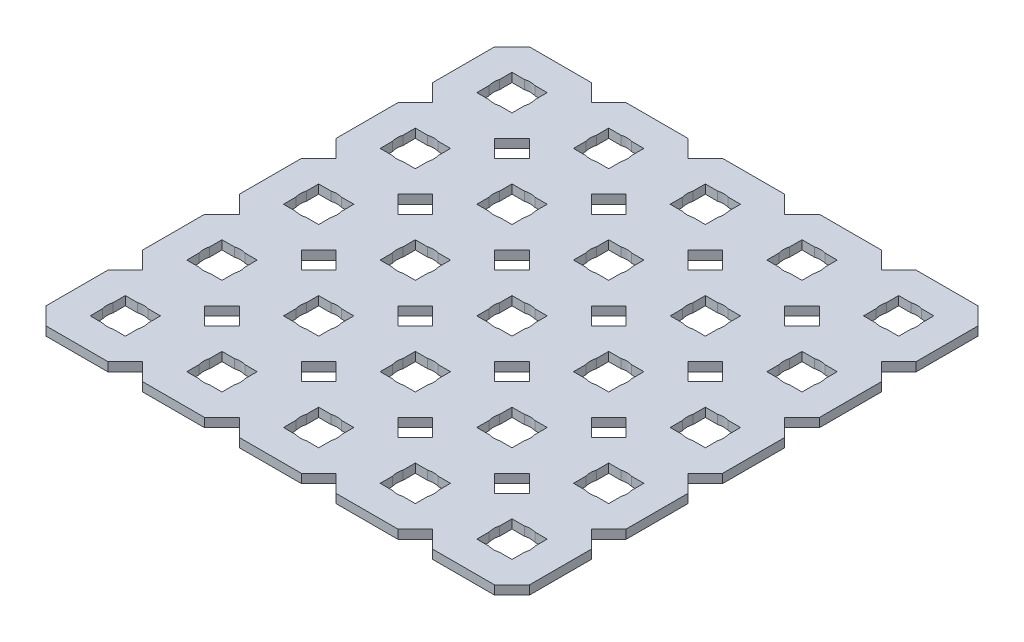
SolidWorks part; units mm, degrees
ref_plane "Front Plane" through (0, 0, 0) normal (0, 0, 1) x (1, 0, 0)
ref_plane "Top Plane" through (0, 0, 0) normal (0, 1, 0) x (1, 0, 0)
ref_plane "Right Plane" through (0, 0, 0) normal (1, 0, 0) x (0, 0, -1)
ref_plane "Plane1" through (0, 0, 0) normal (0, -1, 0) x (1, 0, 0)
sketch "Sketch1" plane through (0, 0, 0) normal (0, -1, 0) x (1, 0, 0)
  line L0 (2.281, -317.5) -> (10.419, -317.5)
  line L1 (10.419, -317.5) -> (12.7, -315.219)
  line L2 (12.7, -315.219) -> (14.981, -317.5)
  line L3 (14.981, -317.5) -> (23.119, -317.5)
  line L4 (23.119, -317.5) -> (25.4, -315.219)
  line L5 (25.4, -315.219) -> (27.681, -317.5)
  line L6 (27.681, -317.5) -> (35.819, -317.5)
  line L7 (35.819, -317.5) -> (38.1, -315.219)
  line L8 (38.1, -315.219) -> (40.381, -317.5)
  line L9 (40.381, -317.5) -> (48.519, -317.5)
  line L10 (48.519, -317.5) -> (50.8, -315.219)
  line L11 (50.8, -315.219) -> (53.081, -317.5)
  line L12 (53.081, -317.5) -> (61.219, -317.5)
  line L13 (61.219, -317.5) -> (63.5, -315.219)
  line L14 (63.5, -315.219) -> (63.5, -307.081)
  line L15 (63.5, -307.081) -> (61.219, -304.8)
  line L16 (61.219, -304.8) -> (63.5, -302.519)
  line L17 (63.5, -302.519) -> (63.5, -294.381)
  line L18 (63.5, -294.381) -> (61.219, -292.1)
  line L19 (61.219, -292.1) -> (63.5, -289.819)
  line L20 (63.5, -289.819) -> (63.5, -281.681)
  line L21 (63.5, -281.681) -> (61.219, -279.4)
  line L22 (61.219, -279.4) -> (63.5, -277.119)
  line L23 (63.5, -277.119) -> (63.5, -268.981)
  line L24 (63.5, -268.981) -> (61.219, -266.7)
  line L25 (61.219, -266.7) -> (63.5, -264.419)
  line L26 (63.5, -264.419) -> (63.5, -256.281)
  line L27 (63.5, -256.281) -> (61.219, -254)
  line L28 (61.219, -254) -> (63.5, -251.719)
  line L29 (63.5, -251.719) -> (63.5, -243.581)
  line L30 (63.5, -243.581) -> (61.219, -241.3)
  line L31 (61.219, -241.3) -> (63.5, -239.019)
  line L32 (63.5, -239.019) -> (63.5, -230.881)
  line L33 (63.5, -230.881) -> (61.219, -228.6)
  line L34 (61.219, -228.6) -> (63.5, -226.319)
  line L35 (63.5, -226.319) -> (63.5, -218.181)
  line L36 (63.5, -218.181) -> (61.219, -215.9)
  line L37 (61.219, -215.9) -> (63.5, -213.619)
  line L38 (63.5, -213.619) -> (63.5, -205.481)
  line L39 (63.5, -205.481) -> (61.219, -203.2)
  line L40 (61.219, -203.2) -> (63.5, -200.919)
  line L41 (63.5, -200.919) -> (63.5, -192.781)
  line L42 (63.5, -192.781) -> (61.219, -190.5)
  line L43 (61.219, -190.5) -> (63.5, -188.219)
  line L44 (63.5, -188.219) -> (63.5, -180.081)
  line L45 (63.5, -180.081) -> (61.219, -177.8)
  line L46 (61.219, -177.8) -> (63.5, -175.519)
  line L47 (63.5, -175.519) -> (63.5, -167.381)
  line L48 (63.5, -167.381) -> (61.219, -165.1)
  line L49 (61.219, -165.1) -> (63.5, -162.819)
  line L50 (63.5, -162.819) -> (63.5, -154.681)
  line L51 (63.5, -154.681) -> (61.219, -152.4)
  line L52 (61.219, -152.4) -> (63.5, -150.119)
  line L53 (63.5, -150.119) -> (63.5, -141.981)
  line L54 (63.5, -141.981) -> (61.219, -139.7)
  line L55 (61.219, -139.7) -> (63.5, -137.419)
  line L56 (63.5, -137.419) -> (63.5, -129.281)
  line L57 (63.5, -129.281) -> (61.219, -127)
  line L58 (61.219, -127) -> (63.5, -124.719)
  line L59 (63.5, -124.719) -> (63.5, -116.581)
  line L60 (63.5, -116.581) -> (61.219, -114.3)
  line L61 (61.219, -114.3) -> (63.5, -112.019)
  line L62 (63.5, -112.019) -> (63.5, -103.881)
  line L63 (63.5, -103.881) -> (61.219, -101.6)
  line L64 (61.219, -101.6) -> (63.5, -99.319)
  line L65 (63.5, -99.319) -> (63.5, -91.181)
  line L66 (63.5, -91.181) -> (61.219, -88.9)
  line L67 (61.219, -88.9) -> (63.5, -86.619)
  line L68 (63.5, -86.619) -> (63.5, -78.481)
  line L69 (63.5, -78.481) -> (61.219, -76.2)
  line L70 (61.219, -76.2) -> (63.5, -73.919)
  line L71 (63.5, -73.919) -> (63.5, -65.781)
  line L72 (63.5, -65.781) -> (61.219, -63.5)
  line L73 (61.219, -63.5) -> (63.5, -61.219)
  line L74 (63.5, -61.219) -> (63.5, -53.081)
  line L75 (63.5, -53.081) -> (61.219, -50.8)
  line L76 (61.219, -50.8) -> (63.5, -48.519)
  line L77 (63.5, -48.519) -> (63.5, -40.381)
  line L78 (63.5, -40.381) -> (61.219, -38.1)
  line L79 (61.219, -38.1) -> (63.5, -35.819)
  line L80 (63.5, -35.819) -> (63.5, -27.681)
  line L81 (63.5, -27.681) -> (61.219, -25.4)
  line L82 (61.219, -25.4) -> (63.5, -23.119)
  line L83 (63.5, -23.119) -> (63.5, -14.981)
  line L84 (63.5, -14.981) -> (61.219, -12.7)
  line L85 (61.219, -12.7) -> (63.5, -10.419)
  line L86 (63.5, -10.419) -> (63.5, -2.281)
  line L87 (63.5, -2.281) -> (61.219, 0)
  line L88 (61.219, 0) -> (53.081, 0)
  line L89 (53.081, 0) -> (50.8, -2.281)
  line L90 (50.8, -2.281) -> (48.519, 0)
  line L91 (48.519, 0) -> (40.381, 0)
  line L92 (40.381, 0) -> (38.1, -2.281)
  line L93 (38.1, -2.281) -> (35.819, 0)
  line L94 (35.819, 0) -> (27.681, 0)
  line L95 (27.681, 0) -> (25.4, -2.281)
  line L96 (25.4, -2.281) -> (23.119, 0)
  line L97 (23.119, 0) -> (14.981, 0)
  line L98 (14.981, 0) -> (12.7, -2.281)
  line L99 (12.7, -2.281) -> (10.419, 0)
  line L100 (10.419, 0) -> (2.281, 0)
  line L101 (2.281, 0) -> (0, -2.281)
  line L102 (0, -2.281) -> (0, -10.419)
  line L103 (0, -10.419) -> (2.281, -12.7)
  line L104 (2.281, -12.7) -> (0, -14.981)
  line L105 (0, -14.981) -> (0, -23.119)
  line L106 (0, -23.119) -> (2.281, -25.4)
  line L107 (2.281, -25.4) -> (0, -27.681)
  line L108 (0, -27.681) -> (0, -35.819)
  line L109 (0, -35.819) -> (2.281, -38.1)
  line L110 (2.281, -38.1) -> (0, -40.381)
  line L111 (0, -40.381) -> (0, -48.519)
  line L112 (0, -48.519) -> (2.281, -50.8)
  line L113 (2.281, -50.8) -> (0, -53.081)
  line L114 (0, -53.081) -> (0, -61.219)
  line L115 (0, -61.219) -> (2.281, -63.5)
  line L116 (2.281, -63.5) -> (0, -65.781)
  line L117 (0, -65.781) -> (0, -73.919)
  line L118 (0, -73.919) -> (2.281, -76.2)
  line L119 (2.281, -76.2) -> (0, -78.481)
  line L120 (0, -78.481) -> (0, -86.619)
  line L121 (0, -86.619) -> (2.281, -88.9)
  line L122 (2.281, -88.9) -> (0, -91.181)
  line L123 (0, -91.181) -> (0, -99.319)
  line L124 (0, -99.319) -> (2.281, -101.6)
  line L125 (2.281, -101.6) -> (0, -103.881)
  line L126 (0, -103.881) -> (0, -112.019)
  line L127 (0, -112.019) -> (2.281, -114.3)
  line L128 (2.281, -114.3) -> (0, -116.581)
  line L129 (0, -116.581) -> (0, -124.719)
  line L130 (0, -124.719) -> (2.281, -127)
  line L131 (2.281, -127) -> (0, -129.281)
  line L132 (0, -129.281) -> (0, -137.419)
  line L133 (0, -137.419) -> (2.281, -139.7)
  line L134 (2.281, -139.7) -> (0, -141.981)
  line L135 (0, -141.981) -> (0, -150.119)
  line L136 (0, -150.119) -> (2.281, -152.4)
  line L137 (2.281, -152.4) -> (0, -154.681)
  line L138 (0, -154.681) -> (0, -162.819)
  line L139 (0, -162.819) -> (2.281, -165.1)
  line L140 (2.281, -165.1) -> (0, -167.381)
  line L141 (0, -167.381) -> (0, -175.519)
  line L142 (0, -175.519) -> (2.281, -177.8)
  line L143 (2.281, -177.8) -> (0, -180.081)
  line L144 (0, -180.081) -> (0, -188.219)
  line L145 (0, -188.219) -> (2.281, -190.5)
  line L146 (2.281, -190.5) -> (0, -192.781)
  line L147 (0, -192.781) -> (0, -200.919)
  line L148 (0, -200.919) -> (2.281, -203.2)
  line L149 (2.281, -203.2) -> (0, -205.481)
  line L150 (0, -205.481) -> (0, -213.619)
  line L151 (0, -213.619) -> (2.281, -215.9)
  line L152 (2.281, -215.9) -> (0, -218.181)
  line L153 (0, -218.181) -> (0, -226.319)
  line L154 (0, -226.319) -> (2.281, -228.6)
  line L155 (2.281, -228.6) -> (0, -230.881)
  line L156 (0, -230.881) -> (0, -239.019)
  line L157 (0, -239.019) -> (2.281, -241.3)
  line L158 (2.281, -241.3) -> (0, -243.581)
  line L159 (0, -243.581) -> (0, -251.719)
  line L160 (0, -251.719) -> (2.281, -254)
  line L161 (2.281, -254) -> (0, -256.281)
  line L162 (0, -256.281) -> (0, -264.419)
  line L163 (0, -264.419) -> (2.281, -266.7)
  line L164 (2.281, -266.7) -> (0, -268.981)
  line L165 (0, -268.981) -> (0, -277.119)
  line L166 (0, -277.119) -> (2.281, -279.4)
  line L167 (2.281, -279.4) -> (0, -281.681)
  line L168 (0, -281.681) -> (0, -289.819)
  line L169 (0, -289.819) -> (2.281, -292.1)
  line L170 (2.281, -292.1) -> (0, -294.381)
  line L171 (0, -294.381) -> (0, -302.519)
  line L172 (0, -302.519) -> (2.281, -304.8)
  line L173 (2.281, -304.8) -> (0, -307.081)
  line L174 (0, -307.081) -> (0, -315.219)
  line L175 (0, -315.219) -> (2.281, -317.5)
  line L176 (14.981, -292.1) -> (12.7, -294.381)
  line L177 (12.7, -294.381) -> (10.419, -292.1)
  line L178 (10.419, -292.1) -> (12.7, -289.819)
  line L179 (12.7, -289.819) -> (14.981, -292.1)
  line L180 (14.981, -266.7) -> (12.7, -268.981)
  line L181 (12.7, -268.981) -> (10.419, -266.7)
  line L182 (10.419, -266.7) -> (12.7, -264.419)
  line L183 (12.7, -264.419) -> (14.981, -266.7)
  line L184 (14.981, -241.3) -> (12.7, -243.581)
  line L185 (12.7, -243.581) -> (10.419, -241.3)
  line L186 (10.419, -241.3) -> (12.7, -239.019)
  line L187 (12.7, -239.019) -> (14.981, -241.3)
  line L188 (14.981, -215.9) -> (12.7, -218.181)
  line L189 (12.7, -218.181) -> (10.419, -215.9)
  line L190 (10.419, -215.9) -> (12.7, -213.619)
  line L191 (12.7, -213.619) -> (14.981, -215.9)
  line L192 (14.981, -190.5) -> (12.7, -192.781)
  line L193 (12.7, -192.781) -> (10.419, -190.5)
  line L194 (10.419, -190.5) -> (12.7, -188.219)
  line L195 (12.7, -188.219) -> (14.981, -190.5)
  line L196 (14.981, -165.1) -> (12.7, -167.381)
  line L197 (12.7, -167.381) -> (10.419, -165.1)
  line L198 (10.419, -165.1) -> (12.7, -162.819)
  line L199 (12.7, -162.819) -> (14.981, -165.1)
  line L200 (14.981, -139.7) -> (12.7, -141.981)
  line L201 (12.7, -141.981) -> (10.419, -139.7)
  line L202 (10.419, -139.7) -> (12.7, -137.419)
  line L203 (12.7, -137.419) -> (14.981, -139.7)
  line L204 (14.981, -114.3) -> (12.7, -116.581)
  line L205 (12.7, -116.581) -> (10.419, -114.3)
  line L206 (10.419, -114.3) -> (12.7, -112.019)
  line L207 (12.7, -112.019) -> (14.981, -114.3)
  line L208 (14.981, -88.9) -> (12.7, -91.181)
  line L209 (12.7, -91.181) -> (10.419, -88.9)
  line L210 (10.419, -88.9) -> (12.7, -86.619)
  line L211 (12.7, -86.619) -> (14.981, -88.9)
  line L212 (14.981, -63.5) -> (12.7, -65.781)
  line L213 (12.7, -65.781) -> (10.419, -63.5)
  line L214 (10.419, -63.5) -> (12.7, -61.219)
  line L215 (12.7, -61.219) -> (14.981, -63.5)
  line L216 (14.981, -38.1) -> (12.7, -40.381)
  line L217 (12.7, -40.381) -> (10.419, -38.1)
  line L218 (10.419, -38.1) -> (12.7, -35.819)
  line L219 (12.7, -35.819) -> (14.981, -38.1)
  line L220 (14.981, -12.7) -> (12.7, -14.981)
  line L221 (12.7, -14.981) -> (10.419, -12.7)
  line L222 (10.419, -12.7) -> (12.7, -10.419)
  line L223 (12.7, -10.419) -> (14.981, -12.7)
  line L224 (27.681, -304.8) -> (25.4, -307.081)
  line L225 (25.4, -307.081) -> (23.119, -304.8)
  line L226 (23.119, -304.8) -> (25.4, -302.519)
  line L227 (25.4, -302.519) -> (27.681, -304.8)
  line L228 (27.681, -279.4) -> (25.4, -281.681)
  line L229 (25.4, -281.681) -> (23.119, -279.4)
  line L230 (23.119, -279.4) -> (25.4, -277.119)
  line L231 (25.4, -277.119) -> (27.681, -279.4)
  line L232 (27.681, -254) -> (25.4, -256.281)
  line L233 (25.4, -256.281) -> (23.119, -254)
  line L234 (23.119, -254) -> (25.4, -251.719)
  line L235 (25.4, -251.719) -> (27.681, -254)
  line L236 (27.681, -228.6) -> (25.4, -230.881)
  line L237 (25.4, -230.881) -> (23.119, -228.6)
  line L238 (23.119, -228.6) -> (25.4, -226.319)
  line L239 (25.4, -226.319) -> (27.681, -228.6)
  line L240 (27.681, -203.2) -> (25.4, -205.481)
  line L241 (25.4, -205.481) -> (23.119, -203.2)
  line L242 (23.119, -203.2) -> (25.4, -200.919)
  line L243 (25.4, -200.919) -> (27.681, -203.2)
  line L244 (27.681, -177.8) -> (25.4, -180.081)
  line L245 (25.4, -180.081) -> (23.119, -177.8)
  line L246 (23.119, -177.8) -> (25.4, -175.519)
  line L247 (25.4, -175.519) -> (27.681, -177.8)
  line L248 (27.681, -152.4) -> (25.4, -154.681)
  line L249 (25.4, -154.681) -> (23.119, -152.4)
  line L250 (23.119, -152.4) -> (25.4, -150.119)
  line L251 (25.4, -150.119) -> (27.681, -152.4)
  line L252 (27.681, -127) -> (25.4, -129.281)
  line L253 (25.4, -129.281) -> (23.119, -127)
  line L254 (23.119, -127) -> (25.4, -124.719)
  line L255 (25.4, -124.719) -> (27.681, -127)
  line L256 (27.681, -101.6) -> (25.4, -103.881)
  line L257 (25.4, -103.881) -> (23.119, -101.6)
  line L258 (23.119, -101.6) -> (25.4, -99.319)
  line L259 (25.4, -99.319) -> (27.681, -101.6)
  line L260 (27.681, -76.2) -> (25.4, -78.481)
  line L261 (25.4, -78.481) -> (23.119, -76.2)
  line L262 (23.119, -76.2) -> (25.4, -73.919)
  line L263 (25.4, -73.919) -> (27.681, -76.2)
  line L264 (27.681, -50.8) -> (25.4, -53.081)
  line L265 (25.4, -53.081) -> (23.119, -50.8)
  line L266 (23.119, -50.8) -> (25.4, -48.519)
  line L267 (25.4, -48.519) -> (27.681, -50.8)
  line L268 (27.681, -25.4) -> (25.4, -27.681)
  line L269 (25.4, -27.681) -> (23.119, -25.4)
  line L270 (23.119, -25.4) -> (25.4, -23.119)
  line L271 (25.4, -23.119) -> (27.681, -25.4)
  line L272 (40.381, -292.1) -> (38.1, -294.381)
  line L273 (38.1, -294.381) -> (35.819, -292.1)
  line L274 (35.819, -292.1) -> (38.1, -289.819)
  line L275 (38.1, -289.819) -> (40.381, -292.1)
  line L276 (40.381, -266.7) -> (38.1, -268.981)
  line L277 (38.1, -268.981) -> (35.819, -266.7)
  line L278 (35.819, -266.7) -> (38.1, -264.419)
  line L279 (38.1, -264.419) -> (40.381, -266.7)
  line L280 (40.381, -241.3) -> (38.1, -243.581)
  line L281 (38.1, -243.581) -> (35.819, -241.3)
  line L282 (35.819, -241.3) -> (38.1, -239.019)
  line L283 (38.1, -239.019) -> (40.381, -241.3)
  line L284 (40.381, -215.9) -> (38.1, -218.181)
  line L285 (38.1, -218.181) -> (35.819, -215.9)
  line L286 (35.819, -215.9) -> (38.1, -213.619)
  line L287 (38.1, -213.619) -> (40.381, -215.9)
  line L288 (40.381, -190.5) -> (38.1, -192.781)
  line L289 (38.1, -192.781) -> (35.819, -190.5)
  line L290 (35.819, -190.5) -> (38.1, -188.219)
  line L291 (38.1, -188.219) -> (40.381, -190.5)
  line L292 (40.381, -165.1) -> (38.1, -167.381)
  line L293 (38.1, -167.381) -> (35.819, -165.1)
  line L294 (35.819, -165.1) -> (38.1, -162.819)
  line L295 (38.1, -162.819) -> (40.381, -165.1)
  line L296 (40.381, -139.7) -> (38.1, -141.981)
  line L297 (38.1, -141.981) -> (35.819, -139.7)
  line L298 (35.819, -139.7) -> (38.1, -137.419)
  line L299 (38.1, -137.419) -> (40.381, -139.7)
  line L300 (40.381, -114.3) -> (38.1, -116.581)
  line L301 (38.1, -116.581) -> (35.819, -114.3)
  line L302 (35.819, -114.3) -> (38.1, -112.019)
  line L303 (38.1, -112.019) -> (40.381, -114.3)
  line L304 (40.381, -88.9) -> (38.1, -91.181)
  line L305 (38.1, -91.181) -> (35.819, -88.9)
  line L306 (35.819, -88.9) -> (38.1, -86.619)
  line L307 (38.1, -86.619) -> (40.381, -88.9)
  line L308 (40.381, -63.5) -> (38.1, -65.781)
  line L309 (38.1, -65.781) -> (35.819, -63.5)
  line L310 (35.819, -63.5) -> (38.1, -61.219)
  line L311 (38.1, -61.219) -> (40.381, -63.5)
  line L312 (40.381, -38.1) -> (38.1, -40.381)
  line L313 (38.1, -40.381) -> (35.819, -38.1)
  line L314 (35.819, -38.1) -> (38.1, -35.819)
  line L315 (38.1, -35.819) -> (40.381, -38.1)
  line L316 (40.381, -12.7) -> (38.1, -14.981)
  line L317 (38.1, -14.981) -> (35.819, -12.7)
  line L318 (35.819, -12.7) -> (38.1, -10.419)
  line L319 (38.1, -10.419) -> (40.381, -12.7)
  line L320 (53.081, -304.8) -> (50.8, -307.081)
  line L321 (50.8, -307.081) -> (48.519, -304.8)
  line L322 (48.519, -304.8) -> (50.8, -302.519)
  line L323 (50.8, -302.519) -> (53.081, -304.8)
  line L324 (53.081, -279.4) -> (50.8, -281.681)
  line L325 (50.8, -281.681) -> (48.519, -279.4)
  line L326 (48.519, -279.4) -> (50.8, -277.119)
  line L327 (50.8, -277.119) -> (53.081, -279.4)
  line L328 (53.081, -254) -> (50.8, -256.281)
  line L329 (50.8, -256.281) -> (48.519, -254)
  line L330 (48.519, -254) -> (50.8, -251.719)
  line L331 (50.8, -251.719) -> (53.081, -254)
  line L332 (53.081, -228.6) -> (50.8, -230.881)
  line L333 (50.8, -230.881) -> (48.519, -228.6)
  line L334 (48.519, -228.6) -> (50.8, -226.319)
  line L335 (50.8, -226.319) -> (53.081, -228.6)
  line L336 (53.081, -203.2) -> (50.8, -205.481)
  line L337 (50.8, -205.481) -> (48.519, -203.2)
  line L338 (48.519, -203.2) -> (50.8, -200.919)
  line L339 (50.8, -200.919) -> (53.081, -203.2)
  line L340 (53.081, -177.8) -> (50.8, -180.081)
  line L341 (50.8, -180.081) -> (48.519, -177.8)
  line L342 (48.519, -177.8) -> (50.8, -175.519)
  line L343 (50.8, -175.519) -> (53.081, -177.8)
  line L344 (53.081, -152.4) -> (50.8, -154.681)
  line L345 (50.8, -154.681) -> (48.519, -152.4)
  line L346 (48.519, -152.4) -> (50.8, -150.119)
  line L347 (50.8, -150.119) -> (53.081, -152.4)
  line L348 (53.081, -127) -> (50.8, -129.281)
  line L349 (50.8, -129.281) -> (48.519, -127)
  line L350 (48.519, -127) -> (50.8, -124.719)
  line L351 (50.8, -124.719) -> (53.081, -127)
  line L352 (53.081, -101.6) -> (50.8, -103.881)
  line L353 (50.8, -103.881) -> (48.519, -101.6)
  line L354 (48.519, -101.6) -> (50.8, -99.319)
  line L355 (50.8, -99.319) -> (53.081, -101.6)
  line L356 (53.081, -76.2) -> (50.8, -78.481)
  line L357 (50.8, -78.481) -> (48.519, -76.2)
  line L358 (48.519, -76.2) -> (50.8, -73.919)
  line L359 (50.8, -73.919) -> (53.081, -76.2)
  line L360 (53.081, -50.8) -> (50.8, -53.081)
  line L361 (50.8, -53.081) -> (48.519, -50.8)
  line L362 (48.519, -50.8) -> (50.8, -48.519)
  line L363 (50.8, -48.519) -> (53.081, -50.8)
  line L364 (53.081, -25.4) -> (50.8, -27.681)
  line L365 (50.8, -27.681) -> (48.519, -25.4)
  line L366 (48.519, -25.4) -> (50.8, -23.119)
  line L367 (50.8, -23.119) -> (53.081, -25.4)
  line L368 (4.0386, -308.8386) -> (8.6614, -308.8386)
  line L369 (8.6614, -308.8386) -> (8.6614, -313.4614)
  line L370 (8.6614, -313.4614) -> (4.0386, -313.4614)
  line L371 (4.0386, -313.4614) -> (4.0386, -308.8386)
  line L372 (16.7386, -308.8386) -> (21.3614, -308.8386)
  line L373 (21.3614, -308.8386) -> (21.3614, -313.4614)
  line L374 (21.3614, -313.4614) -> (16.7386, -313.4614)
  line L375 (16.7386, -313.4614) -> (16.7386, -308.8386)
  line L376 (29.4386, -308.8386) -> (34.0614, -308.8386)
  line L377 (34.0614, -308.8386) -> (34.0614, -313.4614)
  line L378 (34.0614, -313.4614) -> (29.4386, -313.4614)
  line L379 (29.4386, -313.4614) -> (29.4386, -308.8386)
  line L380 (42.1386, -308.8386) -> (46.7614, -308.8386)
  line L381 (46.7614, -308.8386) -> (46.7614, -313.4614)
  line L382 (46.7614, -313.4614) -> (42.1386, -313.4614)
  line L383 (42.1386, -313.4614) -> (42.1386, -308.8386)
  line L384 (54.8386, -308.8386) -> (59.4614, -308.8386)
  line L385 (59.4614, -308.8386) -> (59.4614, -313.4614)
  line L386 (59.4614, -313.4614) -> (54.8386, -313.4614)
  line L387 (54.8386, -313.4614) -> (54.8386, -308.8386)
  line L388 (4.0386, -296.1386) -> (8.6614, -296.1386)
  line L389 (8.6614, -296.1386) -> (8.6614, -300.7614)
  line L390 (8.6614, -300.7614) -> (4.0386, -300.7614)
  line L391 (4.0386, -300.7614) -> (4.0386, -296.1386)
  line L392 (54.8386, -296.1386) -> (59.4614, -296.1386)
  line L393 (59.4614, -296.1386) -> (59.4614, -300.7614)
  line L394 (59.4614, -300.7614) -> (54.8386, -300.7614)
  line L395 (54.8386, -300.7614) -> (54.8386, -296.1386)
  line L396 (4.0386, -283.4386) -> (8.6614, -283.4386)
  line L397 (8.6614, -283.4386) -> (8.6614, -288.0614)
  line L398 (8.6614, -288.0614) -> (4.0386, -288.0614)
  line L399 (4.0386, -288.0614) -> (4.0386, -283.4386)
  line L400 (54.8386, -283.4386) -> (59.4614, -283.4386)
  line L401 (59.4614, -283.4386) -> (59.4614, -288.0614)
  line L402 (59.4614, -288.0614) -> (54.8386, -288.0614)
  line L403 (54.8386, -288.0614) -> (54.8386, -283.4386)
  line L404 (4.0386, -270.7386) -> (8.6614, -270.7386)
  line L405 (8.6614, -270.7386) -> (8.6614, -275.3614)
  line L406 (8.6614, -275.3614) -> (4.0386, -275.3614)
  line L407 (4.0386, -275.3614) -> (4.0386, -270.7386)
  line L408 (54.8386, -270.7386) -> (59.4614, -270.7386)
  line L409 (59.4614, -270.7386) -> (59.4614, -275.3614)
  line L410 (59.4614, -275.3614) -> (54.8386, -275.3614)
  line L411 (54.8386, -275.3614) -> (54.8386, -270.7386)
  line L412 (4.0386, -258.0386) -> (8.6614, -258.0386)
  line L413 (8.6614, -258.0386) -> (8.6614, -262.6614)
  line L414 (8.6614, -262.6614) -> (4.0386, -262.6614)
  line L415 (4.0386, -262.6614) -> (4.0386, -258.0386)
  line L416 (54.8386, -258.0386) -> (59.4614, -258.0386)
  line L417 (59.4614, -258.0386) -> (59.4614, -262.6614)
  line L418 (59.4614, -262.6614) -> (54.8386, -262.6614)
  line L419 (54.8386, -262.6614) -> (54.8386, -258.0386)
  line L420 (4.0386, -245.3386) -> (8.6614, -245.3386)
  line L421 (8.6614, -245.3386) -> (8.6614, -249.9614)
  line L422 (8.6614, -249.9614) -> (4.0386, -249.9614)
  line L423 (4.0386, -249.9614) -> (4.0386, -245.3386)
  line L424 (54.8386, -245.3386) -> (59.4614, -245.3386)
  line L425 (59.4614, -245.3386) -> (59.4614, -249.9614)
  line L426 (59.4614, -249.9614) -> (54.8386, -249.9614)
  line L427 (54.8386, -249.9614) -> (54.8386, -245.3386)
  line L428 (4.0386, -232.6386) -> (8.6614, -232.6386)
  line L429 (8.6614, -232.6386) -> (8.6614, -237.2614)
  line L430 (8.6614, -237.2614) -> (4.0386, -237.2614)
  line L431 (4.0386, -237.2614) -> (4.0386, -232.6386)
  line L432 (54.8386, -232.6386) -> (59.4614, -232.6386)
  line L433 (59.4614, -232.6386) -> (59.4614, -237.2614)
  line L434 (59.4614, -237.2614) -> (54.8386, -237.2614)
  line L435 (54.8386, -237.2614) -> (54.8386, -232.6386)
  line L436 (4.0386, -219.9386) -> (8.6614, -219.9386)
  line L437 (8.6614, -219.9386) -> (8.6614, -224.5614)
  line L438 (8.6614, -224.5614) -> (4.0386, -224.5614)
  line L439 (4.0386, -224.5614) -> (4.0386, -219.9386)
  line L440 (54.8386, -219.9386) -> (59.4614, -219.9386)
  line L441 (59.4614, -219.9386) -> (59.4614, -224.5614)
  line L442 (59.4614, -224.5614) -> (54.8386, -224.5614)
  line L443 (54.8386, -224.5614) -> (54.8386, -219.9386)
  line L444 (4.0386, -207.2386) -> (8.6614, -207.2386)
  line L445 (8.6614, -207.2386) -> (8.6614, -211.8614)
  line L446 (8.6614, -211.8614) -> (4.0386, -211.8614)
  line L447 (4.0386, -211.8614) -> (4.0386, -207.2386)
  line L448 (54.8386, -207.2386) -> (59.4614, -207.2386)
  line L449 (59.4614, -207.2386) -> (59.4614, -211.8614)
  line L450 (59.4614, -211.8614) -> (54.8386, -211.8614)
  line L451 (54.8386, -211.8614) -> (54.8386, -207.2386)
  line L452 (4.0386, -194.5386) -> (8.6614, -194.5386)
  line L453 (8.6614, -194.5386) -> (8.6614, -199.1614)
  line L454 (8.6614, -199.1614) -> (4.0386, -199.1614)
  line L455 (4.0386, -199.1614) -> (4.0386, -194.5386)
  line L456 (54.8386, -194.5386) -> (59.4614, -194.5386)
  line L457 (59.4614, -194.5386) -> (59.4614, -199.1614)
  line L458 (59.4614, -199.1614) -> (54.8386, -199.1614)
  line L459 (54.8386, -199.1614) -> (54.8386, -194.5386)
  line L460 (4.0386, -181.8386) -> (8.6614, -181.8386)
  line L461 (8.6614, -181.8386) -> (8.6614, -186.4614)
  line L462 (8.6614, -186.4614) -> (4.0386, -186.4614)
  line L463 (4.0386, -186.4614) -> (4.0386, -181.8386)
  line L464 (54.8386, -181.8386) -> (59.4614, -181.8386)
  line L465 (59.4614, -181.8386) -> (59.4614, -186.4614)
  line L466 (59.4614, -186.4614) -> (54.8386, -186.4614)
  line L467 (54.8386, -186.4614) -> (54.8386, -181.8386)
  line L468 (4.0386, -169.1386) -> (8.6614, -169.1386)
  line L469 (8.6614, -169.1386) -> (8.6614, -173.7614)
  line L470 (8.6614, -173.7614) -> (4.0386, -173.7614)
  line L471 (4.0386, -173.7614) -> (4.0386, -169.1386)
  line L472 (54.8386, -169.1386) -> (59.4614, -169.1386)
  line L473 (59.4614, -169.1386) -> (59.4614, -173.7614)
  line L474 (59.4614, -173.7614) -> (54.8386, -173.7614)
  line L475 (54.8386, -173.7614) -> (54.8386, -169.1386)
  line L476 (4.0386, -156.4386) -> (8.6614, -156.4386)
  line L477 (8.6614, -156.4386) -> (8.6614, -161.0614)
  line L478 (8.6614, -161.0614) -> (4.0386, -161.0614)
  line L479 (4.0386, -161.0614) -> (4.0386, -156.4386)
  line L480 (54.8386, -156.4386) -> (59.4614, -156.4386)
  line L481 (59.4614, -156.4386) -> (59.4614, -161.0614)
  line L482 (59.4614, -161.0614) -> (54.8386, -161.0614)
  line L483 (54.8386, -161.0614) -> (54.8386, -156.4386)
  line L484 (4.0386, -143.7386) -> (8.6614, -143.7386)
  line L485 (8.6614, -143.7386) -> (8.6614, -148.3614)
  line L486 (8.6614, -148.3614) -> (4.0386, -148.3614)
  line L487 (4.0386, -148.3614) -> (4.0386, -143.7386)
  line L488 (54.8386, -143.7386) -> (59.4614, -143.7386)
  line L489 (59.4614, -143.7386) -> (59.4614, -148.3614)
  line L490 (59.4614, -148.3614) -> (54.8386, -148.3614)
  line L491 (54.8386, -148.3614) -> (54.8386, -143.7386)
  line L492 (4.0386, -131.0386) -> (8.6614, -131.0386)
  line L493 (8.6614, -131.0386) -> (8.6614, -135.6614)
  line L494 (8.6614, -135.6614) -> (4.0386, -135.6614)
  line L495 (4.0386, -135.6614) -> (4.0386, -131.0386)
  line L496 (54.8386, -131.0386) -> (59.4614, -131.0386)
  line L497 (59.4614, -131.0386) -> (59.4614, -135.6614)
  line L498 (59.4614, -135.6614) -> (54.8386, -135.6614)
  line L499 (54.8386, -135.6614) -> (54.8386, -131.0386)
  line L500 (4.0386, -118.3386) -> (8.6614, -118.3386)
  line L501 (8.6614, -118.3386) -> (8.6614, -122.9614)
  line L502 (8.6614, -122.9614) -> (4.0386, -122.9614)
  line L503 (4.0386, -122.9614) -> (4.0386, -118.3386)
  line L504 (54.8386, -118.3386) -> (59.4614, -118.3386)
  line L505 (59.4614, -118.3386) -> (59.4614, -122.9614)
  line L506 (59.4614, -122.9614) -> (54.8386, -122.9614)
  line L507 (54.8386, -122.9614) -> (54.8386, -118.3386)
  line L508 (4.0386, -105.6386) -> (8.6614, -105.6386)
  line L509 (8.6614, -105.6386) -> (8.6614, -110.2614)
  line L510 (8.6614, -110.2614) -> (4.0386, -110.2614)
  line L511 (4.0386, -110.2614) -> (4.0386, -105.6386)
  line L512 (54.8386, -105.6386) -> (59.4614, -105.6386)
  line L513 (59.4614, -105.6386) -> (59.4614, -110.2614)
  line L514 (59.4614, -110.2614) -> (54.8386, -110.2614)
  line L515 (54.8386, -110.2614) -> (54.8386, -105.6386)
  line L516 (4.0386, -92.9386) -> (8.6614, -92.9386)
  line L517 (8.6614, -92.9386) -> (8.6614, -97.5614)
  line L518 (8.6614, -97.5614) -> (4.0386, -97.5614)
  line L519 (4.0386, -97.5614) -> (4.0386, -92.9386)
  line L520 (54.8386, -92.9386) -> (59.4614, -92.9386)
  line L521 (59.4614, -92.9386) -> (59.4614, -97.5614)
  line L522 (59.4614, -97.5614) -> (54.8386, -97.5614)
  line L523 (54.8386, -97.5614) -> (54.8386, -92.9386)
  line L524 (4.0386, -80.2386) -> (8.6614, -80.2386)
  line L525 (8.6614, -80.2386) -> (8.6614, -84.8614)
  line L526 (8.6614, -84.8614) -> (4.0386, -84.8614)
  line L527 (4.0386, -84.8614) -> (4.0386, -80.2386)
  line L528 (54.8386, -80.2386) -> (59.4614, -80.2386)
  line L529 (59.4614, -80.2386) -> (59.4614, -84.8614)
  line L530 (59.4614, -84.8614) -> (54.8386, -84.8614)
  line L531 (54.8386, -84.8614) -> (54.8386, -80.2386)
  line L532 (4.0386, -67.5386) -> (8.6614, -67.5386)
  line L533 (8.6614, -67.5386) -> (8.6614, -72.1614)
  line L534 (8.6614, -72.1614) -> (4.0386, -72.1614)
  line L535 (4.0386, -72.1614) -> (4.0386, -67.5386)
  line L536 (54.8386, -67.5386) -> (59.4614, -67.5386)
  line L537 (59.4614, -67.5386) -> (59.4614, -72.1614)
  line L538 (59.4614, -72.1614) -> (54.8386, -72.1614)
  line L539 (54.8386, -72.1614) -> (54.8386, -67.5386)
  line L540 (4.0386, -54.8386) -> (8.6614, -54.8386)
  line L541 (8.6614, -54.8386) -> (8.6614, -59.4614)
  line L542 (8.6614, -59.4614) -> (4.0386, -59.4614)
  line L543 (4.0386, -59.4614) -> (4.0386, -54.8386)
  line L544 (54.8386, -54.8386) -> (59.4614, -54.8386)
  line L545 (59.4614, -54.8386) -> (59.4614, -59.4614)
  line L546 (59.4614, -59.4614) -> (54.8386, -59.4614)
  line L547 (54.8386, -59.4614) -> (54.8386, -54.8386)
  line L548 (4.0386, -42.1386) -> (8.6614, -42.1386)
  line L549 (8.6614, -42.1386) -> (8.6614, -46.7614)
  line L550 (8.6614, -46.7614) -> (4.0386, -46.7614)
  line L551 (4.0386, -46.7614) -> (4.0386, -42.1386)
  line L552 (54.8386, -42.1386) -> (59.4614, -42.1386)
  line L553 (59.4614, -42.1386) -> (59.4614, -46.7614)
  line L554 (59.4614, -46.7614) -> (54.8386, -46.7614)
  line L555 (54.8386, -46.7614) -> (54.8386, -42.1386)
  line L556 (4.0386, -29.4386) -> (8.6614, -29.4386)
  line L557 (8.6614, -29.4386) -> (8.6614, -34.0614)
  line L558 (8.6614, -34.0614) -> (4.0386, -34.0614)
  line L559 (4.0386, -34.0614) -> (4.0386, -29.4386)
  line L560 (54.8386, -29.4386) -> (59.4614, -29.4386)
  line L561 (59.4614, -29.4386) -> (59.4614, -34.0614)
  line L562 (59.4614, -34.0614) -> (54.8386, -34.0614)
  line L563 (54.8386, -34.0614) -> (54.8386, -29.4386)
  line L564 (4.0386, -16.7386) -> (8.6614, -16.7386)
  line L565 (8.6614, -16.7386) -> (8.6614, -21.3614)
  line L566 (8.6614, -21.3614) -> (4.0386, -21.3614)
  line L567 (4.0386, -21.3614) -> (4.0386, -16.7386)
  line L568 (54.8386, -16.7386) -> (59.4614, -16.7386)
  line L569 (59.4614, -16.7386) -> (59.4614, -21.3614)
  line L570 (59.4614, -21.3614) -> (54.8386, -21.3614)
  line L571 (54.8386, -21.3614) -> (54.8386, -16.7386)
  line L572 (4.0386, -4.0386) -> (8.6614, -4.0386)
  line L573 (8.6614, -4.0386) -> (8.6614, -8.6614)
  line L574 (8.6614, -8.6614) -> (4.0386, -8.6614)
  line L575 (4.0386, -8.6614) -> (4.0386, -4.0386)
  line L576 (16.7386, -4.0386) -> (21.3614, -4.0386)
  line L577 (21.3614, -4.0386) -> (21.3614, -8.6614)
  line L578 (21.3614, -8.6614) -> (16.7386, -8.6614)
  line L579 (16.7386, -8.6614) -> (16.7386, -4.0386)
  line L580 (29.4386, -4.0386) -> (34.0614, -4.0386)
  line L581 (34.0614, -4.0386) -> (34.0614, -8.6614)
  line L582 (34.0614, -8.6614) -> (29.4386, -8.6614)
  line L583 (29.4386, -8.6614) -> (29.4386, -4.0386)
  line L584 (16.7386, -296.1386) -> (21.3614, -296.1386)
  line L585 (21.3614, -296.1386) -> (21.3614, -300.7614)
  line L586 (21.3614, -300.7614) -> (16.7386, -300.7614)
  line L587 (16.7386, -300.7614) -> (16.7386, -296.1386)
  line L588 (29.4386, -296.1386) -> (34.0614, -296.1386)
  line L589 (34.0614, -296.1386) -> (34.0614, -300.7614)
  line L590 (34.0614, -300.7614) -> (29.4386, -300.7614)
  line L591 (29.4386, -300.7614) -> (29.4386, -296.1386)
  line L592 (42.1386, -296.1386) -> (46.7614, -296.1386)
  line L593 (46.7614, -296.1386) -> (46.7614, -300.7614)
  line L594 (46.7614, -300.7614) -> (42.1386, -300.7614)
  line L595 (42.1386, -300.7614) -> (42.1386, -296.1386)
  line L596 (16.7386, -283.4386) -> (21.3614, -283.4386)
  line L597 (21.3614, -283.4386) -> (21.3614, -288.0614)
  line L598 (21.3614, -288.0614) -> (16.7386, -288.0614)
  line L599 (16.7386, -288.0614) -> (16.7386, -283.4386)
  line L600 (29.4386, -283.4386) -> (34.0614, -283.4386)
  line L601 (34.0614, -283.4386) -> (34.0614, -288.0614)
  line L602 (34.0614, -288.0614) -> (29.4386, -288.0614)
  line L603 (29.4386, -288.0614) -> (29.4386, -283.4386)
  line L604 (42.1386, -283.4386) -> (46.7614, -283.4386)
  line L605 (46.7614, -283.4386) -> (46.7614, -288.0614)
  line L606 (46.7614, -288.0614) -> (42.1386, -288.0614)
  line L607 (42.1386, -288.0614) -> (42.1386, -283.4386)
  line L608 (16.7386, -270.7386) -> (21.3614, -270.7386)
  line L609 (21.3614, -270.7386) -> (21.3614, -275.3614)
  line L610 (21.3614, -275.3614) -> (16.7386, -275.3614)
  line L611 (16.7386, -275.3614) -> (16.7386, -270.7386)
  line L612 (29.4386, -270.7386) -> (34.0614, -270.7386)
  line L613 (34.0614, -270.7386) -> (34.0614, -275.3614)
  line L614 (34.0614, -275.3614) -> (29.4386, -275.3614)
  line L615 (29.4386, -275.3614) -> (29.4386, -270.7386)
  line L616 (42.1386, -270.7386) -> (46.7614, -270.7386)
  line L617 (46.7614, -270.7386) -> (46.7614, -275.3614)
  line L618 (46.7614, -275.3614) -> (42.1386, -275.3614)
  line L619 (42.1386, -275.3614) -> (42.1386, -270.7386)
  line L620 (16.7386, -258.0386) -> (21.3614, -258.0386)
  line L621 (21.3614, -258.0386) -> (21.3614, -262.6614)
  line L622 (21.3614, -262.6614) -> (16.7386, -262.6614)
  line L623 (16.7386, -262.6614) -> (16.7386, -258.0386)
  line L624 (29.4386, -258.0386) -> (34.0614, -258.0386)
  line L625 (34.0614, -258.0386) -> (34.0614, -262.6614)
  line L626 (34.0614, -262.6614) -> (29.4386, -262.6614)
  line L627 (29.4386, -262.6614) -> (29.4386, -258.0386)
  line L628 (42.1386, -258.0386) -> (46.7614, -258.0386)
  line L629 (46.7614, -258.0386) -> (46.7614, -262.6614)
  line L630 (46.7614, -262.6614) -> (42.1386, -262.6614)
  line L631 (42.1386, -262.6614) -> (42.1386, -258.0386)
  line L632 (16.7386, -245.3386) -> (21.3614, -245.3386)
  line L633 (21.3614, -245.3386) -> (21.3614, -249.9614)
  line L634 (21.3614, -249.9614) -> (16.7386, -249.9614)
  line L635 (16.7386, -249.9614) -> (16.7386, -245.3386)
  line L636 (29.4386, -245.3386) -> (34.0614, -245.3386)
  line L637 (34.0614, -245.3386) -> (34.0614, -249.9614)
  line L638 (34.0614, -249.9614) -> (29.4386, -249.9614)
  line L639 (29.4386, -249.9614) -> (29.4386, -245.3386)
  line L640 (42.1386, -245.3386) -> (46.7614, -245.3386)
  line L641 (46.7614, -245.3386) -> (46.7614, -249.9614)
  line L642 (46.7614, -249.9614) -> (42.1386, -249.9614)
  line L643 (42.1386, -249.9614) -> (42.1386, -245.3386)
  line L644 (16.7386, -232.6386) -> (21.3614, -232.6386)
  line L645 (21.3614, -232.6386) -> (21.3614, -237.2614)
  line L646 (21.3614, -237.2614) -> (16.7386, -237.2614)
  line L647 (16.7386, -237.2614) -> (16.7386, -232.6386)
  line L648 (29.4386, -232.6386) -> (34.0614, -232.6386)
  line L649 (34.0614, -232.6386) -> (34.0614, -237.2614)
  line L650 (34.0614, -237.2614) -> (29.4386, -237.2614)
  line L651 (29.4386, -237.2614) -> (29.4386, -232.6386)
  line L652 (42.1386, -232.6386) -> (46.7614, -232.6386)
  line L653 (46.7614, -232.6386) -> (46.7614, -237.2614)
  line L654 (46.7614, -237.2614) -> (42.1386, -237.2614)
  line L655 (42.1386, -237.2614) -> (42.1386, -232.6386)
  line L656 (16.7386, -219.9386) -> (21.3614, -219.9386)
  line L657 (21.3614, -219.9386) -> (21.3614, -224.5614)
  line L658 (21.3614, -224.5614) -> (16.7386, -224.5614)
  line L659 (16.7386, -224.5614) -> (16.7386, -219.9386)
  line L660 (29.4386, -219.9386) -> (34.0614, -219.9386)
  line L661 (34.0614, -219.9386) -> (34.0614, -224.5614)
  line L662 (34.0614, -224.5614) -> (29.4386, -224.5614)
  line L663 (29.4386, -224.5614) -> (29.4386, -219.9386)
  line L664 (42.1386, -219.9386) -> (46.7614, -219.9386)
  line L665 (46.7614, -219.9386) -> (46.7614, -224.5614)
  line L666 (46.7614, -224.5614) -> (42.1386, -224.5614)
  line L667 (42.1386, -224.5614) -> (42.1386, -219.9386)
  line L668 (16.7386, -207.2386) -> (21.3614, -207.2386)
  line L669 (21.3614, -207.2386) -> (21.3614, -211.8614)
  line L670 (21.3614, -211.8614) -> (16.7386, -211.8614)
  line L671 (16.7386, -211.8614) -> (16.7386, -207.2386)
  line L672 (29.4386, -207.2386) -> (34.0614, -207.2386)
  line L673 (34.0614, -207.2386) -> (34.0614, -211.8614)
  line L674 (34.0614, -211.8614) -> (29.4386, -211.8614)
  line L675 (29.4386, -211.8614) -> (29.4386, -207.2386)
  line L676 (42.1386, -207.2386) -> (46.7614, -207.2386)
  line L677 (46.7614, -207.2386) -> (46.7614, -211.8614)
  line L678 (46.7614, -211.8614) -> (42.1386, -211.8614)
  line L679 (42.1386, -211.8614) -> (42.1386, -207.2386)
  line L680 (16.7386, -194.5386) -> (21.3614, -194.5386)
  line L681 (21.3614, -194.5386) -> (21.3614, -199.1614)
  line L682 (21.3614, -199.1614) -> (16.7386, -199.1614)
  line L683 (16.7386, -199.1614) -> (16.7386, -194.5386)
  line L684 (29.4386, -194.5386) -> (34.0614, -194.5386)
  line L685 (34.0614, -194.5386) -> (34.0614, -199.1614)
  line L686 (34.0614, -199.1614) -> (29.4386, -199.1614)
  line L687 (29.4386, -199.1614) -> (29.4386, -194.5386)
  line L688 (42.1386, -194.5386) -> (46.7614, -194.5386)
  line L689 (46.7614, -194.5386) -> (46.7614, -199.1614)
  line L690 (46.7614, -199.1614) -> (42.1386, -199.1614)
  line L691 (42.1386, -199.1614) -> (42.1386, -194.5386)
  line L692 (16.7386, -181.8386) -> (21.3614, -181.8386)
  line L693 (21.3614, -181.8386) -> (21.3614, -186.4614)
  line L694 (21.3614, -186.4614) -> (16.7386, -186.4614)
  line L695 (16.7386, -186.4614) -> (16.7386, -181.8386)
  line L696 (29.4386, -181.8386) -> (34.0614, -181.8386)
  line L697 (34.0614, -181.8386) -> (34.0614, -186.4614)
  line L698 (34.0614, -186.4614) -> (29.4386, -186.4614)
  line L699 (29.4386, -186.4614) -> (29.4386, -181.8386)
  line L700 (42.1386, -181.8386) -> (46.7614, -181.8386)
  line L701 (46.7614, -181.8386) -> (46.7614, -186.4614)
  line L702 (46.7614, -186.4614) -> (42.1386, -186.4614)
  line L703 (42.1386, -186.4614) -> (42.1386, -181.8386)
  line L704 (16.7386, -169.1386) -> (21.3614, -169.1386)
  line L705 (21.3614, -169.1386) -> (21.3614, -173.7614)
  line L706 (21.3614, -173.7614) -> (16.7386, -173.7614)
  line L707 (16.7386, -173.7614) -> (16.7386, -169.1386)
  line L708 (29.4386, -169.1386) -> (34.0614, -169.1386)
  line L709 (34.0614, -169.1386) -> (34.0614, -173.7614)
  line L710 (34.0614, -173.7614) -> (29.4386, -173.7614)
  line L711 (29.4386, -173.7614) -> (29.4386, -169.1386)
  line L712 (42.1386, -169.1386) -> (46.7614, -169.1386)
  line L713 (46.7614, -169.1386) -> (46.7614, -173.7614)
  line L714 (46.7614, -173.7614) -> (42.1386, -173.7614)
  line L715 (42.1386, -173.7614) -> (42.1386, -169.1386)
  line L716 (16.7386, -156.4386) -> (21.3614, -156.4386)
  line L717 (21.3614, -156.4386) -> (21.3614, -161.0614)
  line L718 (21.3614, -161.0614) -> (16.7386, -161.0614)
  line L719 (16.7386, -161.0614) -> (16.7386, -156.4386)
  line L720 (29.4386, -156.4386) -> (34.0614, -156.4386)
  line L721 (34.0614, -156.4386) -> (34.0614, -161.0614)
  line L722 (34.0614, -161.0614) -> (29.4386, -161.0614)
  line L723 (29.4386, -161.0614) -> (29.4386, -156.4386)
  line L724 (42.1386, -156.4386) -> (46.7614, -156.4386)
  line L725 (46.7614, -156.4386) -> (46.7614, -161.0614)
  line L726 (46.7614, -161.0614) -> (42.1386, -161.0614)
  line L727 (42.1386, -161.0614) -> (42.1386, -156.4386)
  line L728 (16.7386, -143.7386) -> (21.3614, -143.7386)
  line L729 (21.3614, -143.7386) -> (21.3614, -148.3614)
  line L730 (21.3614, -148.3614) -> (16.7386, -148.3614)
  line L731 (16.7386, -148.3614) -> (16.7386, -143.7386)
  line L732 (29.4386, -143.7386) -> (34.0614, -143.7386)
  line L733 (34.0614, -143.7386) -> (34.0614, -148.3614)
  line L734 (34.0614, -148.3614) -> (29.4386, -148.3614)
  line L735 (29.4386, -148.3614) -> (29.4386, -143.7386)
  line L736 (42.1386, -143.7386) -> (46.7614, -143.7386)
  line L737 (46.7614, -143.7386) -> (46.7614, -148.3614)
  line L738 (46.7614, -148.3614) -> (42.1386, -148.3614)
  line L739 (42.1386, -148.3614) -> (42.1386, -143.7386)
  line L740 (16.7386, -131.0386) -> (21.3614, -131.0386)
  line L741 (21.3614, -131.0386) -> (21.3614, -135.6614)
  line L742 (21.3614, -135.6614) -> (16.7386, -135.6614)
  line L743 (16.7386, -135.6614) -> (16.7386, -131.0386)
  line L744 (29.4386, -131.0386) -> (34.0614, -131.0386)
  line L745 (34.0614, -131.0386) -> (34.0614, -135.6614)
  line L746 (34.0614, -135.6614) -> (29.4386, -135.6614)
  line L747 (29.4386, -135.6614) -> (29.4386, -131.0386)
  line L748 (42.1386, -131.0386) -> (46.7614, -131.0386)
  line L749 (46.7614, -131.0386) -> (46.7614, -135.6614)
  line L750 (46.7614, -135.6614) -> (42.1386, -135.6614)
  line L751 (42.1386, -135.6614) -> (42.1386, -131.0386)
  line L752 (16.7386, -118.3386) -> (21.3614, -118.3386)
  line L753 (21.3614, -118.3386) -> (21.3614, -122.9614)
  line L754 (21.3614, -122.9614) -> (16.7386, -122.9614)
  line L755 (16.7386, -122.9614) -> (16.7386, -118.3386)
  line L756 (29.4386, -118.3386) -> (34.0614, -118.3386)
  line L757 (34.0614, -118.3386) -> (34.0614, -122.9614)
  line L758 (34.0614, -122.9614) -> (29.4386, -122.9614)
  line L759 (29.4386, -122.9614) -> (29.4386, -118.3386)
  line L760 (42.1386, -118.3386) -> (46.7614, -118.3386)
  line L761 (46.7614, -118.3386) -> (46.7614, -122.9614)
  line L762 (46.7614, -122.9614) -> (42.1386, -122.9614)
  line L763 (42.1386, -122.9614) -> (42.1386, -118.3386)
  line L764 (16.7386, -105.6386) -> (21.3614, -105.6386)
  line L765 (21.3614, -105.6386) -> (21.3614, -110.2614)
  line L766 (21.3614, -110.2614) -> (16.7386, -110.2614)
  line L767 (16.7386, -110.2614) -> (16.7386, -105.6386)
  line L768 (29.4386, -105.6386) -> (34.0614, -105.6386)
  line L769 (34.0614, -105.6386) -> (34.0614, -110.2614)
  line L770 (34.0614, -110.2614) -> (29.4386, -110.2614)
  line L771 (29.4386, -110.2614) -> (29.4386, -105.6386)
  line L772 (42.1386, -105.6386) -> (46.7614, -105.6386)
  line L773 (46.7614, -105.6386) -> (46.7614, -110.2614)
  line L774 (46.7614, -110.2614) -> (42.1386, -110.2614)
  line L775 (42.1386, -110.2614) -> (42.1386, -105.6386)
  line L776 (16.7386, -92.9386) -> (21.3614, -92.9386)
  line L777 (21.3614, -92.9386) -> (21.3614, -97.5614)
  line L778 (21.3614, -97.5614) -> (16.7386, -97.5614)
  line L779 (16.7386, -97.5614) -> (16.7386, -92.9386)
  line L780 (29.4386, -92.9386) -> (34.0614, -92.9386)
  line L781 (34.0614, -92.9386) -> (34.0614, -97.5614)
  line L782 (34.0614, -97.5614) -> (29.4386, -97.5614)
  line L783 (29.4386, -97.5614) -> (29.4386, -92.9386)
  line L784 (42.1386, -92.9386) -> (46.7614, -92.9386)
  line L785 (46.7614, -92.9386) -> (46.7614, -97.5614)
  line L786 (46.7614, -97.5614) -> (42.1386, -97.5614)
  line L787 (42.1386, -97.5614) -> (42.1386, -92.9386)
  line L788 (16.7386, -80.2386) -> (21.3614, -80.2386)
  line L789 (21.3614, -80.2386) -> (21.3614, -84.8614)
  line L790 (21.3614, -84.8614) -> (16.7386, -84.8614)
  line L791 (16.7386, -84.8614) -> (16.7386, -80.2386)
  line L792 (29.4386, -80.2386) -> (34.0614, -80.2386)
  line L793 (34.0614, -80.2386) -> (34.0614, -84.8614)
  line L794 (34.0614, -84.8614) -> (29.4386, -84.8614)
  line L795 (29.4386, -84.8614) -> (29.4386, -80.2386)
  line L796 (42.1386, -80.2386) -> (46.7614, -80.2386)
  line L797 (46.7614, -80.2386) -> (46.7614, -84.8614)
  line L798 (46.7614, -84.8614) -> (42.1386, -84.8614)
  line L799 (42.1386, -84.8614) -> (42.1386, -80.2386)
  line L800 (16.7386, -67.5386) -> (21.3614, -67.5386)
  line L801 (21.3614, -67.5386) -> (21.3614, -72.1614)
  line L802 (21.3614, -72.1614) -> (16.7386, -72.1614)
  line L803 (16.7386, -72.1614) -> (16.7386, -67.5386)
  line L804 (29.4386, -67.5386) -> (34.0614, -67.5386)
  line L805 (34.0614, -67.5386) -> (34.0614, -72.1614)
  line L806 (34.0614, -72.1614) -> (29.4386, -72.1614)
  line L807 (29.4386, -72.1614) -> (29.4386, -67.5386)
  line L808 (42.1386, -67.5386) -> (46.7614, -67.5386)
  line L809 (46.7614, -67.5386) -> (46.7614, -72.1614)
  line L810 (46.7614, -72.1614) -> (42.1386, -72.1614)
  line L811 (42.1386, -72.1614) -> (42.1386, -67.5386)
  line L812 (16.7386, -54.8386) -> (21.3614, -54.8386)
  line L813 (21.3614, -54.8386) -> (21.3614, -59.4614)
  line L814 (21.3614, -59.4614) -> (16.7386, -59.4614)
  line L815 (16.7386, -59.4614) -> (16.7386, -54.8386)
  line L816 (29.4386, -54.8386) -> (34.0614, -54.8386)
  line L817 (34.0614, -54.8386) -> (34.0614, -59.4614)
  line L818 (34.0614, -59.4614) -> (29.4386, -59.4614)
  line L819 (29.4386, -59.4614) -> (29.4386, -54.8386)
  line L820 (42.1386, -54.8386) -> (46.7614, -54.8386)
  line L821 (46.7614, -54.8386) -> (46.7614, -59.4614)
  line L822 (46.7614, -59.4614) -> (42.1386, -59.4614)
  line L823 (42.1386, -59.4614) -> (42.1386, -54.8386)
  line L824 (16.7386, -42.1386) -> (21.3614, -42.1386)
  line L825 (21.3614, -42.1386) -> (21.3614, -46.7614)
  line L826 (21.3614, -46.7614) -> (16.7386, -46.7614)
  line L827 (16.7386, -46.7614) -> (16.7386, -42.1386)
  line L828 (29.4386, -42.1386) -> (34.0614, -42.1386)
  line L829 (34.0614, -42.1386) -> (34.0614, -46.7614)
  line L830 (34.0614, -46.7614) -> (29.4386, -46.7614)
  line L831 (29.4386, -46.7614) -> (29.4386, -42.1386)
  line L832 (42.1386, -42.1386) -> (46.7614, -42.1386)
  line L833 (46.7614, -42.1386) -> (46.7614, -46.7614)
  line L834 (46.7614, -46.7614) -> (42.1386, -46.7614)
  line L835 (42.1386, -46.7614) -> (42.1386, -42.1386)
  line L836 (16.7386, -29.4386) -> (21.3614, -29.4386)
  line L837 (21.3614, -29.4386) -> (21.3614, -34.0614)
  line L838 (21.3614, -34.0614) -> (16.7386, -34.0614)
  line L839 (16.7386, -34.0614) -> (16.7386, -29.4386)
  line L840 (29.4386, -29.4386) -> (34.0614, -29.4386)
  line L841 (34.0614, -29.4386) -> (34.0614, -34.0614)
  line L842 (34.0614, -34.0614) -> (29.4386, -34.0614)
  line L843 (29.4386, -34.0614) -> (29.4386, -29.4386)
  line L844 (42.1386, -29.4386) -> (46.7614, -29.4386)
  line L845 (46.7614, -29.4386) -> (46.7614, -34.0614)
  line L846 (46.7614, -34.0614) -> (42.1386, -34.0614)
  line L847 (42.1386, -34.0614) -> (42.1386, -29.4386)
  line L848 (16.7386, -16.7386) -> (21.3614, -16.7386)
  line L849 (21.3614, -16.7386) -> (21.3614, -21.3614)
  line L850 (21.3614, -21.3614) -> (16.7386, -21.3614)
  line L851 (16.7386, -21.3614) -> (16.7386, -16.7386)
  line L852 (29.4386, -16.7386) -> (34.0614, -16.7386)
  line L853 (34.0614, -16.7386) -> (34.0614, -21.3614)
  line L854 (34.0614, -21.3614) -> (29.4386, -21.3614)
  line L855 (29.4386, -21.3614) -> (29.4386, -16.7386)
  line L856 (54.8386, -8.6614) -> (54.8386, -4.0386)
  line L857 (54.8386, -4.0386) -> (59.4614, -4.0386)
  line L858 (59.4614, -4.0386) -> (59.4614, -8.6614)
  line L859 (59.4614, -8.6614) -> (54.8386, -8.6614)
  line L860 (42.1386, -21.3614) -> (42.1386, -16.7386)
  line L861 (42.1386, -16.7386) -> (46.7614, -16.7386)
  line L862 (46.7614, -16.7386) -> (46.7614, -21.3614)
  line L863 (46.7614, -21.3614) -> (42.1386, -21.3614)
  line L864 (42.1386, -8.6614) -> (42.1386, -4.0386)
  line L865 (42.1386, -4.0386) -> (46.7614, -4.0386)
  line L866 (46.7614, -4.0386) -> (46.7614, -8.6614)
  line L867 (46.7614, -8.6614) -> (42.1386, -8.6614)
  line L868 (53.081, -12.7) -> (50.8, -14.981)
  line L869 (50.8, -14.981) -> (48.519, -12.7)
  line L870 (48.519, -12.7) -> (50.8, -10.419)
  line L871 (50.8, -10.419) -> (53.081, -12.7)
  line L872 (53.081, -38.1) -> (50.8, -40.381)
  line L873 (50.8, -40.381) -> (48.519, -38.1)
  line L874 (48.519, -38.1) -> (50.8, -35.819)
  line L875 (50.8, -35.819) -> (53.081, -38.1)
  line L876 (53.081, -63.5) -> (50.8, -65.781)
  line L877 (50.8, -65.781) -> (48.519, -63.5)
  line L878 (48.519, -63.5) -> (50.8, -61.219)
  line L879 (50.8, -61.219) -> (53.081, -63.5)
  line L880 (53.081, -88.9) -> (50.8, -91.181)
  line L881 (50.8, -91.181) -> (48.519, -88.9)
  line L882 (48.519, -88.9) -> (50.8, -86.619)
  line L883 (50.8, -86.619) -> (53.081, -88.9)
  line L884 (53.081, -114.3) -> (50.8, -116.581)
  line L885 (50.8, -116.581) -> (48.519, -114.3)
  line L886 (48.519, -114.3) -> (50.8, -112.019)
  line L887 (50.8, -112.019) -> (53.081, -114.3)
  line L888 (53.081, -139.7) -> (50.8, -141.981)
  line L889 (50.8, -141.981) -> (48.519, -139.7)
  line L890 (48.519, -139.7) -> (50.8, -137.419)
  line L891 (50.8, -137.419) -> (53.081, -139.7)
  line L892 (53.081, -165.1) -> (50.8, -167.381)
  line L893 (50.8, -167.381) -> (48.519, -165.1)
  line L894 (48.519, -165.1) -> (50.8, -162.819)
  line L895 (50.8, -162.819) -> (53.081, -165.1)
  line L896 (53.081, -190.5) -> (50.8, -192.781)
  line L897 (50.8, -192.781) -> (48.519, -190.5)
  line L898 (48.519, -190.5) -> (50.8, -188.219)
  line L899 (50.8, -188.219) -> (53.081, -190.5)
  line L900 (53.081, -215.9) -> (50.8, -218.181)
  line L901 (50.8, -218.181) -> (48.519, -215.9)
  line L902 (48.519, -215.9) -> (50.8, -213.619)
  line L903 (50.8, -213.619) -> (53.081, -215.9)
  line L904 (53.081, -241.3) -> (50.8, -243.581)
  line L905 (50.8, -243.581) -> (48.519, -241.3)
  line L906 (48.519, -241.3) -> (50.8, -239.019)
  line L907 (50.8, -239.019) -> (53.081, -241.3)
  line L908 (53.081, -266.7) -> (50.8, -268.981)
  line L909 (50.8, -268.981) -> (48.519, -266.7)
  line L910 (48.519, -266.7) -> (50.8, -264.419)
  line L911 (50.8, -264.419) -> (53.081, -266.7)
  line L912 (53.081, -292.1) -> (50.8, -294.381)
  line L913 (50.8, -294.381) -> (48.519, -292.1)
  line L914 (48.519, -292.1) -> (50.8, -289.819)
  line L915 (50.8, -289.819) -> (53.081, -292.1)
  line L916 (40.381, -25.4) -> (38.1, -27.681)
  line L917 (38.1, -27.681) -> (35.819, -25.4)
  line L918 (35.819, -25.4) -> (38.1, -23.119)
  line L919 (38.1, -23.119) -> (40.381, -25.4)
  line L920 (40.381, -50.8) -> (38.1, -53.081)
  line L921 (38.1, -53.081) -> (35.819, -50.8)
  line L922 (35.819, -50.8) -> (38.1, -48.519)
  line L923 (38.1, -48.519) -> (40.381, -50.8)
  line L924 (40.381, -76.2) -> (38.1, -78.481)
  line L925 (38.1, -78.481) -> (35.819, -76.2)
  line L926 (35.819, -76.2) -> (38.1, -73.919)
  line L927 (38.1, -73.919) -> (40.381, -76.2)
  line L928 (40.381, -101.6) -> (38.1, -103.881)
  line L929 (38.1, -103.881) -> (35.819, -101.6)
  line L930 (35.819, -101.6) -> (38.1, -99.319)
  line L931 (38.1, -99.319) -> (40.381, -101.6)
  line L932 (40.381, -127) -> (38.1, -129.281)
  line L933 (38.1, -129.281) -> (35.819, -127)
  line L934 (35.819, -127) -> (38.1, -124.719)
  line L935 (38.1, -124.719) -> (40.381, -127)
  line L936 (40.381, -152.4) -> (38.1, -154.681)
  line L937 (38.1, -154.681) -> (35.819, -152.4)
  line L938 (35.819, -152.4) -> (38.1, -150.119)
  line L939 (38.1, -150.119) -> (40.381, -152.4)
  line L940 (40.381, -177.8) -> (38.1, -180.081)
  line L941 (38.1, -180.081) -> (35.819, -177.8)
  line L942 (35.819, -177.8) -> (38.1, -175.519)
  line L943 (38.1, -175.519) -> (40.381, -177.8)
  line L944 (40.381, -203.2) -> (38.1, -205.481)
  line L945 (38.1, -205.481) -> (35.819, -203.2)
  line L946 (35.819, -203.2) -> (38.1, -200.919)
  line L947 (38.1, -200.919) -> (40.381, -203.2)
  line L948 (40.381, -228.6) -> (38.1, -230.881)
  line L949 (38.1, -230.881) -> (35.819, -228.6)
  line L950 (35.819, -228.6) -> (38.1, -226.319)
  line L951 (38.1, -226.319) -> (40.381, -228.6)
  line L952 (40.381, -254) -> (38.1, -256.281)
  line L953 (38.1, -256.281) -> (35.819, -254)
  line L954 (35.819, -254) -> (38.1, -251.719)
  line L955 (38.1, -251.719) -> (40.381, -254)
  line L956 (40.381, -279.4) -> (38.1, -281.681)
  line L957 (38.1, -281.681) -> (35.819, -279.4)
  line L958 (35.819, -279.4) -> (38.1, -277.119)
  line L959 (38.1, -277.119) -> (40.381, -279.4)
  line L960 (40.381, -304.8) -> (38.1, -307.081)
  line L961 (38.1, -307.081) -> (35.819, -304.8)
  line L962 (35.819, -304.8) -> (38.1, -302.519)
  line L963 (38.1, -302.519) -> (40.381, -304.8)
  line L964 (27.681, -12.7) -> (25.4, -14.981)
  line L965 (25.4, -14.981) -> (23.119, -12.7)
  line L966 (23.119, -12.7) -> (25.4, -10.419)
  line L967 (25.4, -10.419) -> (27.681, -12.7)
  line L968 (27.681, -38.1) -> (25.4, -40.381)
  line L969 (25.4, -40.381) -> (23.119, -38.1)
  line L970 (23.119, -38.1) -> (25.4, -35.819)
  line L971 (25.4, -35.819) -> (27.681, -38.1)
  line L972 (27.681, -63.5) -> (25.4, -65.781)
  line L973 (25.4, -65.781) -> (23.119, -63.5)
  line L974 (23.119, -63.5) -> (25.4, -61.219)
  line L975 (25.4, -61.219) -> (27.681, -63.5)
  line L976 (27.681, -88.9) -> (25.4, -91.181)
  line L977 (25.4, -91.181) -> (23.119, -88.9)
  line L978 (23.119, -88.9) -> (25.4, -86.619)
  line L979 (25.4, -86.619) -> (27.681, -88.9)
  line L980 (27.681, -114.3) -> (25.4, -116.581)
  line L981 (25.4, -116.581) -> (23.119, -114.3)
  line L982 (23.119, -114.3) -> (25.4, -112.019)
  line L983 (25.4, -112.019) -> (27.681, -114.3)
  line L984 (27.681, -139.7) -> (25.4, -141.981)
  line L985 (25.4, -141.981) -> (23.119, -139.7)
  line L986 (23.119, -139.7) -> (25.4, -137.419)
  line L987 (25.4, -137.419) -> (27.681, -139.7)
  line L988 (27.681, -165.1) -> (25.4, -167.381)
  line L989 (25.4, -167.381) -> (23.119, -165.1)
  line L990 (23.119, -165.1) -> (25.4, -162.819)
  line L991 (25.4, -162.819) -> (27.681, -165.1)
  line L992 (27.681, -190.5) -> (25.4, -192.781)
  line L993 (25.4, -192.781) -> (23.119, -190.5)
  line L994 (23.119, -190.5) -> (25.4, -188.219)
  line L995 (25.4, -188.219) -> (27.681, -190.5)
  line L996 (27.681, -215.9) -> (25.4, -218.181)
  line L997 (25.4, -218.181) -> (23.119, -215.9)
  line L998 (23.119, -215.9) -> (25.4, -213.619)
  line L999 (25.4, -213.619) -> (27.681, -215.9)
  line L1000 (27.681, -241.3) -> (25.4, -243.581)
  line L1001 (25.4, -243.581) -> (23.119, -241.3)
  line L1002 (23.119, -241.3) -> (25.4, -239.019)
  line L1003 (25.4, -239.019) -> (27.681, -241.3)
  line L1004 (27.681, -266.7) -> (25.4, -268.981)
  line L1005 (25.4, -268.981) -> (23.119, -266.7)
  line L1006 (23.119, -266.7) -> (25.4, -264.419)
  line L1007 (25.4, -264.419) -> (27.681, -266.7)
  line L1008 (27.681, -292.1) -> (25.4, -294.381)
  line L1009 (25.4, -294.381) -> (23.119, -292.1)
  line L1010 (23.119, -292.1) -> (25.4, -289.819)
  line L1011 (25.4, -289.819) -> (27.681, -292.1)
  line L1012 (14.981, -25.4) -> (12.7, -27.681)
  line L1013 (12.7, -27.681) -> (10.419, -25.4)
  line L1014 (10.419, -25.4) -> (12.7, -23.119)
  line L1015 (12.7, -23.119) -> (14.981, -25.4)
  line L1016 (14.981, -50.8) -> (12.7, -53.081)
  line L1017 (12.7, -53.081) -> (10.419, -50.8)
  line L1018 (10.419, -50.8) -> (12.7, -48.519)
  line L1019 (12.7, -48.519) -> (14.981, -50.8)
  line L1020 (14.981, -76.2) -> (12.7, -78.481)
  line L1021 (12.7, -78.481) -> (10.419, -76.2)
  line L1022 (10.419, -76.2) -> (12.7, -73.919)
  line L1023 (12.7, -73.919) -> (14.981, -76.2)
  line L1024 (14.981, -101.6) -> (12.7, -103.881)
  line L1025 (12.7, -103.881) -> (10.419, -101.6)
  line L1026 (10.419, -101.6) -> (12.7, -99.319)
  line L1027 (12.7, -99.319) -> (14.981, -101.6)
  line L1028 (14.981, -127) -> (12.7, -129.281)
  line L1029 (12.7, -129.281) -> (10.419, -127)
  line L1030 (10.419, -127) -> (12.7, -124.719)
  line L1031 (12.7, -124.719) -> (14.981, -127)
  line L1032 (14.981, -152.4) -> (12.7, -154.681)
  line L1033 (12.7, -154.681) -> (10.419, -152.4)
  line L1034 (10.419, -152.4) -> (12.7, -150.119)
  line L1035 (12.7, -150.119) -> (14.981, -152.4)
  line L1036 (14.981, -177.8) -> (12.7, -180.081)
  line L1037 (12.7, -180.081) -> (10.419, -177.8)
  line L1038 (10.419, -177.8) -> (12.7, -175.519)
  line L1039 (12.7, -175.519) -> (14.981, -177.8)
  line L1040 (14.981, -203.2) -> (12.7, -205.481)
  line L1041 (12.7, -205.481) -> (10.419, -203.2)
  line L1042 (10.419, -203.2) -> (12.7, -200.919)
  line L1043 (12.7, -200.919) -> (14.981, -203.2)
  line L1044 (14.981, -228.6) -> (12.7, -230.881)
  line L1045 (12.7, -230.881) -> (10.419, -228.6)
  line L1046 (10.419, -228.6) -> (12.7, -226.319)
  line L1047 (12.7, -226.319) -> (14.981, -228.6)
  line L1048 (14.981, -254) -> (12.7, -256.281)
  line L1049 (12.7, -256.281) -> (10.419, -254)
  line L1050 (10.419, -254) -> (12.7, -251.719)
  line L1051 (12.7, -251.719) -> (14.981, -254)
  line L1052 (14.981, -279.4) -> (12.7, -281.681)
  line L1053 (12.7, -281.681) -> (10.419, -279.4)
  line L1054 (10.419, -279.4) -> (12.7, -277.119)
  line L1055 (12.7, -277.119) -> (14.981, -279.4)
  line L1056 (14.981, -304.8) -> (12.7, -307.081)
  line L1057 (12.7, -307.081) -> (10.419, -304.8)
  line L1058 (10.419, -304.8) -> (12.7, -302.519)
  line L1059 (12.7, -302.519) -> (14.981, -304.8)
extrude "Boss-Extrude1" add sketch "Sketch1" against normal blind 1.1684
sketch "Sketch2" plane through (0, 1.1684, 0) normal (0, 1, 0) x (1, 0, 0)
  line L0 (4.0386, 8.6614) -> (8.6614, 4.0386) construction
  circle A0 centre (6.35, 6.35) radius 2.413
  dimension "D1" = 4.826
extrude "Cut-Extrude1" cut sketch "Sketch2" against normal through all
pattern_linear "LPattern1" count 5 spacing 12.7 along (1, 0, 0) count 25 spacing 12.7 along (0, 0, -1) of "Cut-Extrude1"
sketch "Sketch3" plane through (0, 1.1684, 0) normal (0, 1, 0) x (1, 0, 0)
  line L0 (0, 192.781) -> (0, 200.919) construction
  line L1 (0, 317.5) -> (63.5, 317.5)
  line L2 (0, 317.5) -> (0, 63.5)
  line L3 (0, 63.5) -> (63.5, 63.5)
  line L4 (63.5, 317.5) -> (63.5, 63.5)
  line L5 (14.981, 317.5) -> (23.119, 317.5) construction
  line L6 (63.5, 213.619) -> (63.5, 205.481) construction
extrude "Cut-Extrude2" cut sketch "Sketch3" against normal through all
